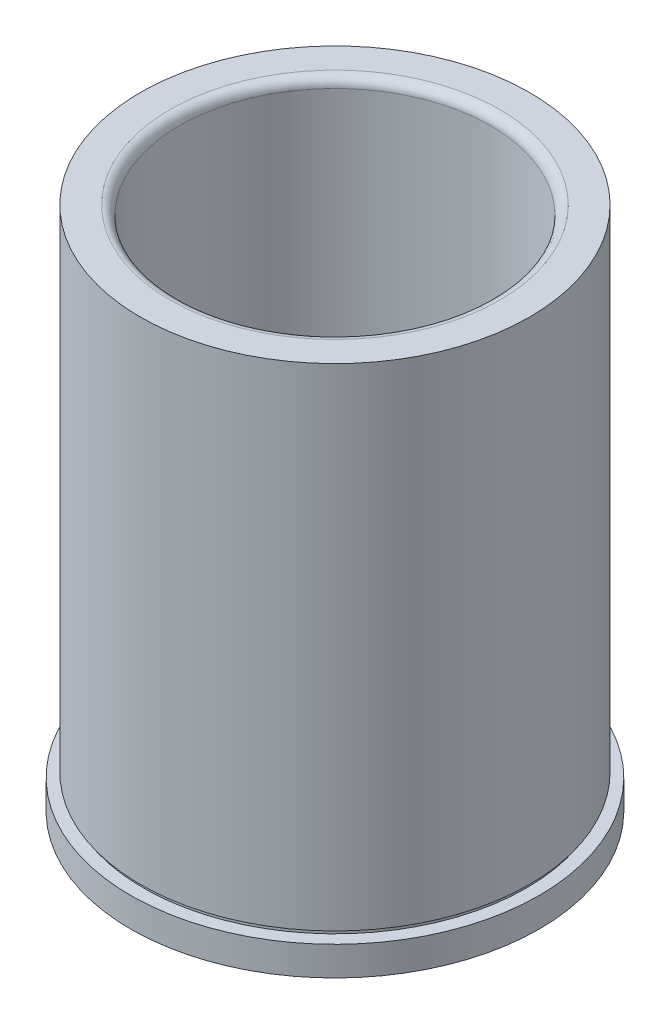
SolidWorks part; units mm, degrees
ref_plane "Front Plane" through (0, 0, 0) normal (0, 0, 1) x (1, 0, 0)
ref_plane "Top Plane" through (0, 0, 0) normal (0, 1, 0) x (1, 0, 0)
ref_plane "Right Plane" through (0, 0, 0) normal (1, 0, 0) x (0, 0, -1)
sketch "Sketch1" plane through (0, 0, 0) normal (0, 0, 1) x (1, 0, 0)
  line L0 (-911.3132, 435.3443) -> (44205.0492, -21117.2388) construction
  line L1 (0, -1000) -> (0, 49000) construction
  line L2 (-25.4063, 101.6507) -> (-25.4063, 16.7417)
  line L3 (-26.2224, 15.9257) -> (-33.3375, 15.9257)
  line L4 (-33.3375, 15.9257) -> (-33.3375, 20.6882)
  line L5 (-33.3375, 20.6882) -> (-31.2483, 20.6882)
  line L6 (-31.7564, 101.6507) -> (-31.7563, 21.4502)
  line L7 (-31.7564, 101.6507) -> (-25.4063, 101.6507)
  line L8 (-26.2224, 15.9257) -> (-25.4063, 16.7417)
  line L10 (-31.7563, 21.4502) -> (-31.2483, 21.4502)
  line L11 (-31.2483, 21.4502) -> (-31.2483, 20.6882)
  dimension "D1" = 0.508
  dimension "OD" = 63.5127
  dimension "ID" = 50.8127
  dimension "FLANGETHICKNESS" = 4.7625
  dimension "FLANGEDIA" = 66.675
  dimension "D2" = 45
  dimension "D3" = 0.762
  dimension "OVERALL LENGTH" = 85.725
revolve "Revolve1" add sketch "Sketch1" angle 360 about L1
fillet "Fillet1" radius 1.524 1 edges at (25.4063, 101.6507, 0)
